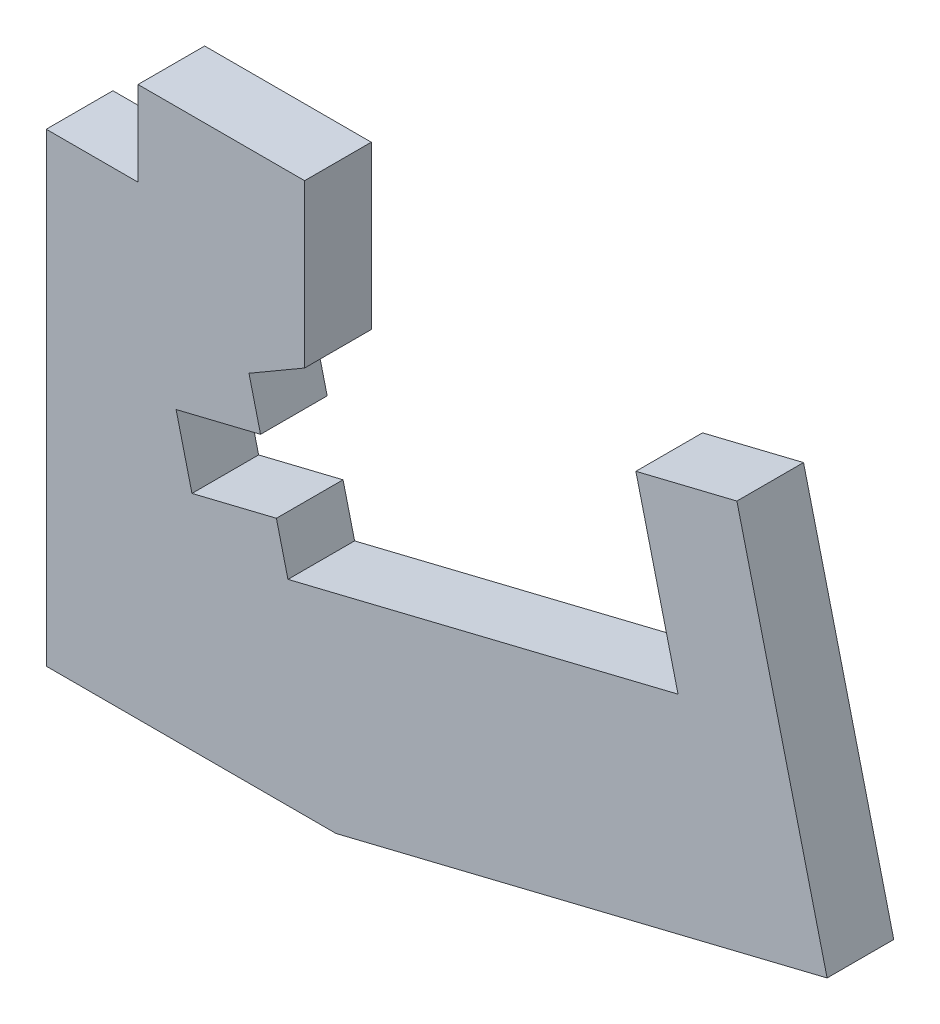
SolidWorks part; units mm, degrees
ref_plane "Front" through (0, 0, 0) normal (0, 0, 1) x (1, 0, 0)
ref_plane "Top" through (0, 0, 0) normal (0, 1, 0) x (1, 0, 0)
ref_plane "Right" through (0, 0, 0) normal (1, 0, 0) x (0, 0, -1)
sketch "Sketch1" plane through (0, 0, 0) normal (0, 0, 1) x (1, 0, 0)
  line L0 (0, 40.7645) -> (0, 0)
  line L1 (0, 0) -> (25.4, 0)
  line L2 (21.1869, 17.1851) -> (25.4, 0) construction
  line L3 (21.1869, 17.1851) -> (55.3788, 25.5676)
  line L4 (17.7698, 31.1233) -> (18.7828, 26.9912)
  line L5 (17.7698, 31.1233) -> (22.6479, 33.9596)
  line L6 (22.6479, 33.9596) -> (22.6479, 48.182)
  line L7 (22.6479, 48.182) -> (8.0438, 48.182)
  line L8 (8.0438, 48.182) -> (8.0438, 40.7645)
  line L9 (8.0438, 40.7645) -> (0, 40.7645)
  line L10 (21.1869, 17.1851) -> (-48.9101, 0) construction
  line L11 (0, 0) -> (-48.9101, 0) construction
  line L12 (17.7698, 31.1233) -> (-26.1712, 5.5747) construction
  line L13 (25.4, 0) -> (68.4469, 10.5534)
  line L14 (68.4469, 10.5534) -> (60.5394, 42.8078)
  line L15 (60.5394, 42.8078) -> (51.6843, 40.6369)
  line L16 (51.6843, 40.6369) -> (55.3788, 25.5676)
  line L17 (38.2828, 21.3763) -> (30.6987, 52.3118) construction
  line L18 (23.9146, 50.6486) -> (37.4827, 53.975) construction
  line L19 (18.7828, 26.9912) -> (11.382, 25.1768)
  line L20 (11.382, 25.1768) -> (12.773, 19.5028)
  line L21 (17.7698, 31.1233) -> (21.1869, 17.1851) construction
  line L22 (12.773, 19.5028) -> (20.1739, 21.3172)
  line L23 (20.1739, 21.3172) -> (21.1869, 17.1851)
  line L24 (19.4783, 24.1542) -> (12.0775, 22.3398) construction
  dimension "D1" = 13.775
  dimension "D2" = 14.351
  dimension "D3" = 16.4
  dimension "D4" = 35.2044
  dimension "D5" = 31.8516
  dimension "D6" = 13.97
  dimension "D7" = 25.4
  dimension "D8" = 53.975
  dimension "D9" = 5.842
  dimension "D10" = 7.62
extrude "Extrude1" add sketch "Sketch1" along normal blind 5.842
